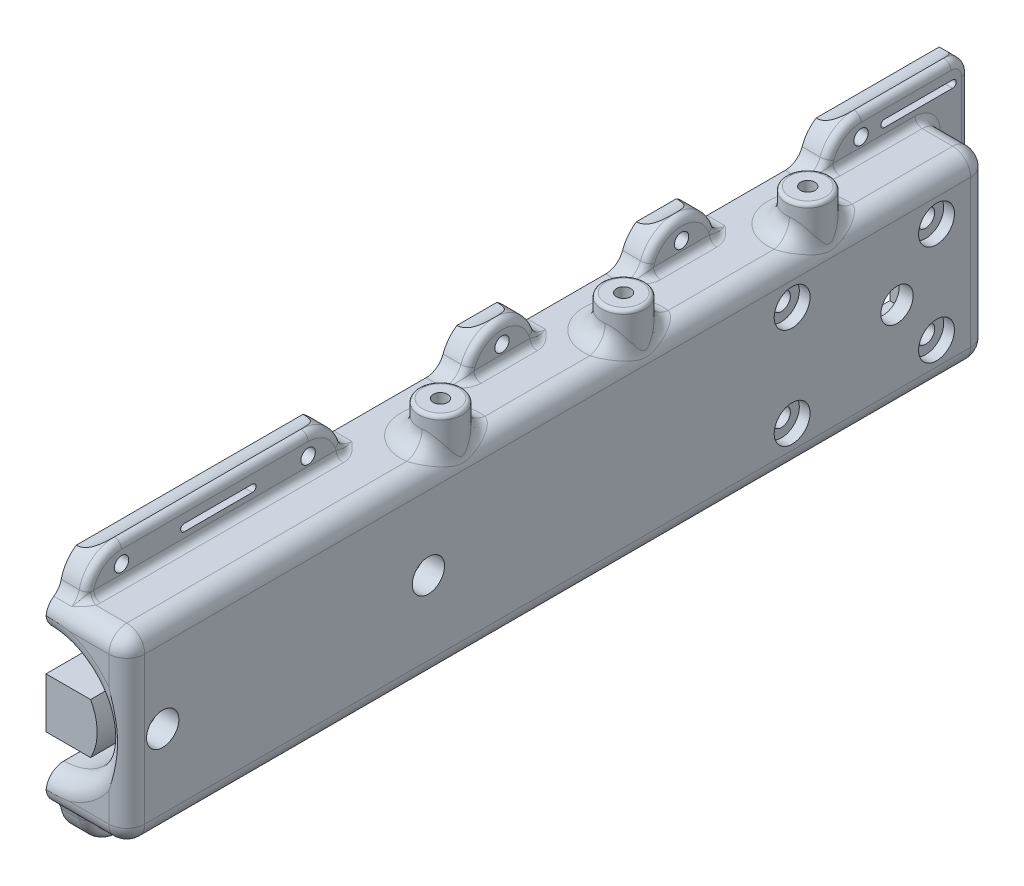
SolidWorks part; units mm, degrees
ref_plane "Plan de face" through (0, 0, 0) normal (0, 0, 1) x (1, 0, 0)
ref_plane "Plan de dessus" through (0, 0, 0) normal (0, 1, 0) x (1, 0, 0)
ref_plane "Plan de droite" through (0, 0, 0) normal (1, 0, 0) x (0, 0, -1)
sketch "Esquisse1" plane through (0, 0, 0) normal (1, 0, 0) x (0, 0, -1)
  line L5 (0, 0) -> (-240, 0)
  line L6 (0, 0) -> (0, 51)
  line L7 (0, 51) -> (-240, 51)
  line L8 (-240, 0) -> (-240, 51)
  dimension "D3" = 51
  dimension "D4" = 240
extrude "Boss.-Extru.2" add sketch "Esquisse1" along normal blind 22.5
sketch "Esquisse2" plane through (0, 0, 0) normal (-1, 0, 0) x (0, 0, 1)
  line L0 (0, 0) -> (0, 51) construction
  line L1 (5, 46) -> (64.2, 46)
  line L2 (5, 46) -> (5, 5)
  line L3 (5, 5) -> (64.2, 5)
  line L4 (64.2, 46) -> (64.2, 5)
  point P6 (5, 25.5)
  point P7 (0, 25.5)
  dimension "D1" = 41
  dimension "D2" = 59.2
  dimension "D3" = 5
extrude "Enlèv. mat.-Extru.1" cut sketch "Esquisse2" against normal blind 15.6
sketch "Esquisse3" plane through (0, 0, 0) normal (-1, 0, 0) x (0, 0, 1)
  line L0 (64.2, 5) -> (64.2, 46) construction
  line L1 (129.2, 42) -> (64.2, 42)
  line L2 (129.2, 42) -> (129.2, 9)
  line L3 (129.2, 9) -> (64.2, 9)
  line L4 (64.2, 42) -> (64.2, 9)
  point P7 (64.2, 25.5)
  point P8 (64.2, 25.5)
  dimension "D1" = 33
  dimension "D2" = 65
extrude "Enlèv. mat.-Extru.2" cut sketch "Esquisse3" against normal blind 21.6
fillet "Congé1" radius 17 2 edges at (21.6, 9, 96.7) (21.6, 42, 96.7)
sketch "Esquisse4" plane through (15.6, 0, 0) normal (-1, 0, 0) x (0, 0, 1)
  line L0 (5, 46) -> (5, 5) construction
  line L1 (64.2, 46) -> (5, 46) construction
  circle A0 centre (14.5, 39.5) radius 2.5
  circle A1 centre (54.7, 39.5) radius 2.5
  circle A2 centre (54.7, 11.5) radius 2.5
  circle A3 centre (14.5, 11.5) radius 2.5
  dimension "D3" = 5
  dimension "D1" = 40.2
  dimension "D2" = 28
  dimension "D4" = 9.5
  dimension "D5" = 6.5
extrude "Enlèv. mat.-Extru.4" cut sketch "Esquisse4" against normal through all
sketch "Esquisse5" plane through (15.6, 0, 0) normal (-1, 0, 0) x (0, 0, 1)
  line L0 (5, 46) -> (5, 5) construction
  line L1 (5, 46) -> (5, 5) construction
  circle A0 centre (25.5, 25.5) radius 10
  point P7 (5, 25.5)
  dimension "D1" = 20
  dimension "D2" = 20.5
extrude "Enlèv. mat.-Extru.5" cut sketch "Esquisse5" against normal blind 3
sketch "Esquisse6" plane through (18.6, 0, 0) normal (-1, 0, 0) x (0, 0, 1)
  circle A0 centre (25.5, 25.5) radius 4.5
  circle A1 centre (25.5, 25.5) radius 10 construction
  dimension "D1" = 9
extrude "Enlèv. mat.-Extru.6" cut sketch "Esquisse6" against normal through all
sketch "Esquisse7" plane through (0, 0, 240) normal (0, 0, 1) x (1, 0, 0)
  line L0 (0, 51) -> (0, 0) construction
  circle A0 centre (0, 25.5) radius 14.25
  circle A1 centre (0, 25.5) radius 16.5
  dimension "D1" = 28.5
  dimension "D2" = 33
extrude "Enlèv. mat.-Extru.7" cut sketch "Esquisse7" against normal blind 100
sketch "Esquisse8" plane through (22.5, 0, 0) normal (1, 0, 0) x (0, 0, -1)
  line L0 (-240, 51) -> (-240, 0) construction
  circle A0 centre (-230, 25.5) radius 4.5
  circle A1 centre (-156, 25.5) radius 4.5
  point P7 (-240, 25.5)
  dimension "D1" = 9
  dimension "D2" = 74
  dimension "D3" = 10
extrude "Enlèv. mat.-Extru.8" cut sketch "Esquisse8" against normal through all
sketch "Esquisse9" plane through (0, 0, 240) normal (0, 0, 1) x (1, 0, 0)
  line L0 (-0.9801, 40.4) -> (-0.9801, 32.5)
  line L1 (-0.9801, 32.5) -> (13.7913, 32.5)
  line L2 (-0.9801, 10.6) -> (-0.9801, 18.5)
  line L4 (-0.9801, 18.5) -> (13.7913, 18.5)
  spline S0 degree 3 poles (-0.9801, 40.4) (1.9842, 40.2871) (8.4104, 40.1159) (12.8329, 35.266) (13.7913, 32.5) knots 0 0 0 0 0.512203 1 1 1 1
  spline S2 degree 3 poles (-0.9801, 10.6) (1.902, 10.0791) (8.428, 10.7944) (12.2618, 16.0303) (13.7913, 18.5) knots 0 0 0 0 0.497728 1 1 1 1
  dimension "D3" = 1.6
  dimension "D1" = 14
  dimension "D2" = 1.6
extrude "Enlèv. mat.-Extru.9" cut sketch "Esquisse9" against normal up to surface (100 mm away)
fillet "Congé2" radius 7 2 edges at (6.2061, 18.5, 140) (6.2061, 32.5, 140)
sketch "Esquisse10" plane through (0, 0, 0) normal (-1, 0, 0) x (0, 0, 1)
  line L0 (0, 0) -> (0, 51) construction
  line L1 (0, 51) -> (240, 51) construction
  line L2 (240, 0) -> (0, 0) construction
  line L3 (0, 35.5) -> (0, 15.5)
  line L4 (10, 51) -> (30, 51)
  line L5 (110, 51) -> (130, 51)
  line L6 (216, 51) -> (236, 51)
  line L7 (236, 0) -> (216, 0)
  line L8 (130, 0) -> (110, 0)
  line L9 (30, 0) -> (10, 0)
  line L10 (60, 51) -> (80, 51)
  line L11 (60, 0) -> (80, 0)
  line L12 (164, 0) -> (184, 0)
  line L13 (164, 51) -> (184, 51)
  arc A0 (0, 35.5) -> (0, 15.5) centre (0, 25.5) ccw
  arc A1 (130, 51) -> (110, 51) centre (120, 51) ccw
  arc A2 (130, 0) -> (110, 0) centre (120, 0) cw
  arc A3 (30, 51) -> (10, 51) centre (20, 51) ccw
  arc A4 (30, 0) -> (10, 0) centre (20, 0) cw
  arc A5 (236, 51) -> (216, 51) centre (226, 51) ccw
  arc A6 (236, 0) -> (216, 0) centre (226, 0) cw
  arc A7 (80, 51) -> (60, 51) centre (70, 51) ccw
  arc A8 (80, 0) -> (60, 0) centre (70, 0) cw
  arc A9 (184, 51) -> (164, 51) centre (174, 51) ccw
  arc A10 (184, 0) -> (164, 0) centre (174, 0) cw
  dimension "D5" = 10
  dimension "D1" = 100
  dimension "D2" = 106
  dimension "D3" = 50
  dimension "D4" = 54
extrude "Boss.-Extru.3" add sketch "Esquisse10" against normal blind 7
fillet "Congé3" radius 5 31 edges at (11.25, 51, 240) (22.5, 25.5, 240) (11.25, 0, 240) (16.5, 25.5, 240) (3.5, 0, 130) (3.5, 0, 110) (3.5, 0, 164) (3.5, 0, 184) (3.5, 0, 236) (3.5, 0, 216) (3.5, 0, 80) (3.5, 0, 60) (3.5, 0, 30) (3.5, 0, 10) (3.5, 51, 184) (3.5, 51, 164) (3.5, 51, 110) (3.5, 51, 130) (3.5, 51, 60) (3.5, 51, 80) (3.5, 51, 10) (3.5, 51, 30) (3.5, 51, 236) (3.5, 51, 216) (3.5, 35.5, 0) (3.5, 15.5, 0) (22.5, 0, 120) (11.25, 0, 0) (22.5, 51, 120) (22.5, 25.5, 0) (11.25, 51, 0)
fillet "Congé4" radius 5 2 edges at (3.5, 50.8991, 235.9995) (3.5, 0.1009, 235.9995)
fillet "Congé5" radius 2 28 edges at (7, 51.9175, 58.7446) (7, 51, 70) (7, 51.9175, 81.2554) (7, 61, 70) (7, 51.9175, 108.7446) (7, 51, 120) (7, 51.9175, 131.2554) (7, 61, 120) (7, -0.4534, 236.5017) (7, 0, 223.4289) (7, -0.9175, 214.7446) (7, -9.9817, 226.6047) (7, -0.9175, 185.2554) (7, 0, 174) (7, -0.9175, 162.7446) (7, -10, 174) (7, -0.9175, 131.2554) (7, 0, 120) (7, -0.9175, 108.7446) (7, -10, 120) (7, -0.9175, 81.2554) (7, 0, 70) (7, -0.9175, 58.7446) (7, -10, 70) (7, -0.9175, 31.2554) (7, 0, 20) (7, -0.9175, 8.7446) (7, -10, 20)
sketch "Esquisse11" plane through (22.5, 0, 0) normal (1, 0, 0) x (0, 0, -1)
  circle A0 centre (-54.7, 39.5) radius 5
  circle A1 centre (-14.5, 39.5) radius 5
  circle A2 centre (-14.5, 11.5) radius 5
  circle A3 centre (-54.7, 11.5) radius 5
  dimension "D1" = 10
extrude "Enlèv. mat.-Extru.10" cut sketch "Esquisse11" against normal blind 3
sketch "Esquisse12" plane through (7, 0, 0) normal (1, 0, 0) x (0, 0, -1)
  line L2 (-12.1824, -2) -> (-27.8176, -2) construction
  line L3 (-77.8176, 53) -> (-62.1824, 53) construction
  line L4 (-127.8176, 53) -> (-112.1824, 53) construction
  line L9 (0, 11.3579) -> (0, 39.6421) construction
  line L10 (-5.8579, 51) -> (-34.1421, 51) construction
  line L11 (-166.1824, -2) -> (-181.8176, -2) construction
  line L12 (-218.1824, -2) -> (-233.746, -2) construction
  circle A0 centre (-225.9642, 55.5) radius 2
  circle A1 centre (-174, 55.5) radius 2
  circle A2 centre (-120, 55.5) radius 2
  circle A3 centre (-70, 55.5) radius 2
  circle A4 centre (-20, 55.5) radius 2
  circle A5 centre (4.5, 25.5) radius 2
  circle A6 centre (-20, -5.5) radius 2
  circle A7 centre (-70, -5.5) radius 2
  circle A8 centre (-120, -5.5) radius 2
  circle A9 centre (-174, -5.5) radius 2
  circle A10 centre (-225.9642, -5.5) radius 2
  point P37 (-20, 51)
  point P38 (0, 25.5)
  point P42 (-70, 53)
  point P46 (-120, 53)
  point P50 (-174, -2)
  point P55 (-225.9642, -2)
  dimension "D1" = 4
  dimension "D2" = 4.5
  dimension "D3" = 4.5
  dimension "D4" = 3.5
extrude "Enlèv. mat.-Extru.13" cut sketch "Esquisse12" against normal blind 8
sketch "Esquisse13" plane through (0, 0, 0) normal (-1, 0, 0) x (0, 0, 1)
  line L1 (5, 49) -> (129.2, 49)
  line L2 (2, 46) -> (2, 5)
  line L3 (5, 2) -> (129.2, 2)
  line L4 (132.2, 46) -> (132.2, 5)
  line L5 (6.5, 47.5) -> (127.7, 47.5)
  line L6 (3.5, 44.5) -> (3.5, 6.5)
  line L7 (6.5, 3.5) -> (127.7, 3.5)
  line L8 (130.7, 44.5) -> (130.7, 6.5)
  line L12 (64.2, 46) -> (5, 46) construction
  line L13 (5, 5) -> (64.2, 5) construction
  line L14 (5, 46) -> (5, 5) construction
  line L15 (129.2, 25.5) -> (129.2, 9) construction
  arc A0 (129.2, 49) -> (132.2, 46) centre (129.2, 46) cw
  arc A1 (127.7, 47.5) -> (130.7, 44.5) centre (127.7, 44.5) cw
  arc A2 (127.7, 3.5) -> (130.7, 6.5) centre (127.7, 6.5) ccw
  arc A3 (129.2, 2) -> (132.2, 5) centre (129.2, 5) ccw
  arc A4 (2, 5) -> (5, 2) centre (5, 5) ccw
  arc A5 (3.5, 6.5) -> (6.5, 3.5) centre (6.5, 6.5) ccw
  arc A6 (5, 49) -> (2, 46) centre (5, 46) ccw
  arc A7 (6.5, 47.5) -> (3.5, 44.5) centre (6.5, 44.5) ccw
  dimension "D9" = 3
  dimension "D1" = 1.5
  dimension "D2" = 1.5
  dimension "D3" = 1.5
  dimension "D4" = 1.5
  dimension "D5" = 1.5
  dimension "D6" = 1.5
  dimension "D7" = 1.5
  dimension "D8" = 1.5
extrude "Enlèv. mat.-Extru.12" cut sketch "Esquisse13" against normal blind 1.5
sketch "Esquisse14" plane through (0, 0, 0) normal (-1, 0, 0) x (0, 0, 1)
  line L0 (-10, 25.5) -> (-10, 56)
  line L1 (-5, 61) -> (20, 61)
  line L2 (174, 61) -> (226, 61)
  line L5 (226, 61) -> (219.8325, 55.2525)
  line L6 (219.8325, 55.2525) -> (219.8325, 48.5354)
  line L7 (219.8325, 48.5354) -> (180.9207, 48.5354)
  line L8 (180.9207, 48.5354) -> (180.9207, 55.2525)
  line L9 (180.9207, 55.2525) -> (174, 61)
  arc A1 (-3.3333, 34.9281) -> (-3.3333, 16.0719) centre (0, 25.5) ccw construction
  arc A2 (29.4281, 54.3333) -> (10.5719, 54.3333) centre (20, 51) ccw construction
  arc A5 (-10, 56) -> (-5, 61) centre (-5, 56) cw
  arc A6 (183.4281, 54.3333) -> (164.5719, 54.3333) centre (174, 51) ccw construction
  arc A7 (235.7615, 53.1708) -> (216.5719, 54.3333) centre (226, 51) ccw construction
  spline S0 degree 3 poles (20, 61) (15.2022, 59.5588) (13.9247, 51.4496) (6.7381, 49.8469) (2.8745, 50.2641) (0.6037, 46.8259) (0.94, 42.8087) (1.6303, 37.6206) (-4.8938, 32.9339) (-7.0932, 27.7912) (-10, 25.5) knots 0 0 0 0 0.279239 0.3589 0.42165 0.497851 0.563562 0.667075 0.782325 1 1 1 1
  point P3 (16.9419, 59.0778)
  dimension "D1" = 5
extrude "Boss.-Extru.4" add sketch "Esquisse14" against normal up to surface (7 mm away)
sketch "Esquisse15" plane through (0, 0, 0) normal (-1, 0, 0) x (0, 0, 1)
  line L0 (-5.5, 55.5) -> (13.5, 55.5) construction
  line L1 (-5.5, 56.5) -> (13.5, 56.5)
  line L2 (-5.5, 54.5) -> (13.5, 54.5)
  line L3 (20, 61) -> (-5, 61) construction
  line L4 (-10, 56) -> (-10, 25.5) construction
  line L5 (189.5, 55.5) -> (208.5, 55.5) construction
  line L6 (189.5, 56.5) -> (208.5, 56.5)
  line L7 (189.5, 54.5) -> (208.5, 54.5)
  arc A0 (-5.5, 56.5) -> (-5.5, 54.5) centre (-5.5, 55.5) ccw
  arc A1 (13.5, 54.5) -> (13.5, 56.5) centre (13.5, 55.5) ccw
  arc A2 (189.5, 56.5) -> (189.5, 54.5) centre (189.5, 55.5) ccw
  arc A3 (208.5, 54.5) -> (208.5, 56.5) centre (208.5, 55.5) ccw
  circle A4 centre (174, 55.5) radius 2 construction
  point P2 (4, 55.5)
  point P7 (199, 55.5)
  dimension "D1" = 2
  dimension "D2" = 19
  dimension "D3" = 5.5
  dimension "D4" = 4.5
  dimension "D5" = 2
  dimension "D6" = 19
  dimension "D7" = 25
extrude "Enlèv. mat.-Extru.14" cut sketch "Esquisse15" against normal blind 8
fillet "Congé6" radius 2 16 edges at (7, 14.2446, -0.9175) (7, 19.7265, -8.165) (7, 28.6789, 0) (7, 49.5355, 1.4645) (7, 51, 19.5711) (7, 40.75, -10) (7, 59.5355, -8.5355) (7, 61, 7.5) (7, 59.165, 25.7735) (7, 51.9175, 31.2554) (7, 51, 197.4289) (7, 51.9175, 162.7446) (7, 59.165, 168.2265) (7, 61, 200) (7, 58.8009, 232.2567) (7, 51.4534, 236.5017)
sketch "Esquisse16" plane through (0, 0, -10) normal (0, 0, -1) x (-1, 0, 0)
  circle A0 centre (0, 67.5622) radius 8.25
  dimension "D1" = 16.5
extrude "Enlèv. mat.-Extru.15" cut sketch "Esquisse16" against normal up to surface (250 mm away)
sketch "Esquisse17" plane through (0, 51, 0) normal (0, 1, 0) x (1, 0, 0)
  line L0 (0, -55.8579) -> (5, -55.8579) construction
  line L3 (5, -134.1421) -> (0, -134.1421) construction
  line L4 (0, -34.1421) -> (0, -55.8579) construction
  circle A0 centre (16, -43.8579) radius 6
  circle A1 centre (16, -146.1421) radius 6
  circle A2 centre (16, -95.1421) radius 6
  dimension "D1" = 12
  dimension "D2" = 12
  dimension "D3" = 12
  dimension "D4" = 51
  dimension "D5" = 16
extrude "Boss.-Extru.5" add sketch "Esquisse17" along normal blind 9
sketch "Esquisse18" plane through (0, 60, 0) normal (0, 1, 0) x (1, 0, 0)
  circle A0 centre (16, -146.1421) radius 6
  circle A1 centre (16, -95.1421) radius 6
  circle A2 centre (16, -43.8579) radius 6
extrude "Boss.-Extru.6" add sketch "Esquisse18" against normal blind 12.5
fillet "Congé11" radius 5 6 edges at (21.9931, 48.1937, 44.1461) (10, 51, 43.8579) (21.9931, 48.1937, 95.4304) (10, 51, 95.1421) (21.9941, 48.1915, 146.4072) (10, 51, 146.1421)
fillet "Congé7" radius 1 3 edges at (16, 60, 49.8579) (16, 60, 101.1421) (16, 60, 152.1421)
sketch "Esquisse25" plane through (0, 60, 0) normal (0, 1, 0) x (1, 0, 0)
  circle A0 centre (16, -43.8579) radius 2
  circle A1 centre (16, -43.8579) radius 5 construction
  circle A2 centre (16, -95.1421) radius 2
  circle A3 centre (16, -146.1421) radius 2
  circle A4 centre (16, -146.1421) radius 5 construction
  circle A5 centre (16, -95.1421) radius 5 construction
  dimension "D1" = 4
extrude "Enlèv. mat.-Extru.16" cut sketch "Esquisse25" against normal blind 8
